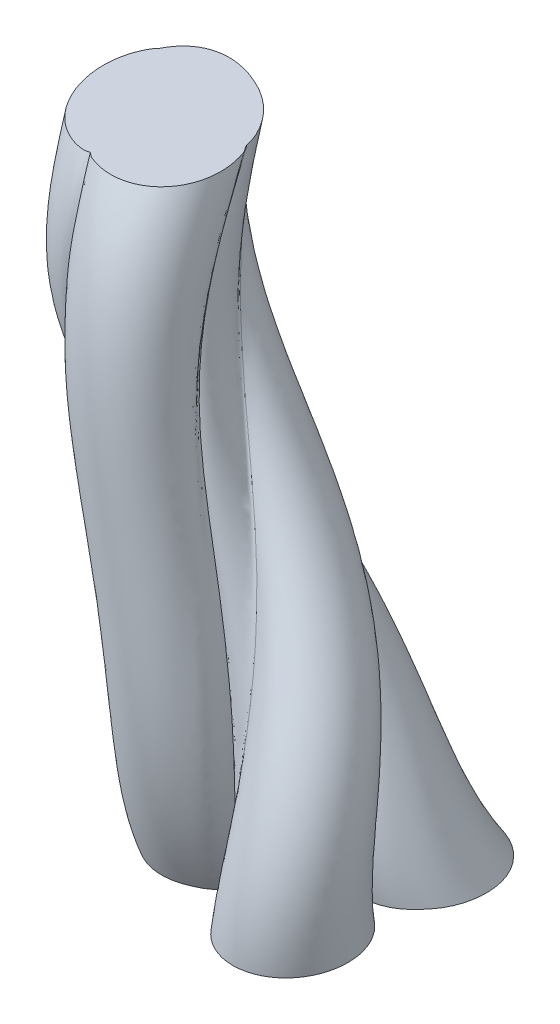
SolidWorks part; units mm, degrees
ref_plane "Front Plane" through (0, 0, 0) normal (0, 0, 1) x (1, 0, 0)
ref_plane "Top Plane" through (0, 0, 0) normal (0, 1, 0) x (1, 0, 0)
ref_plane "Right Plane" through (0, 0, 0) normal (1, 0, 0) x (0, 0, -1)
sketch "Sketch1" plane through (0, 0, 0) normal (0, 1, 0) x (1, 0, 0)
  line L0 (-4.3301, 7.5) -> (0, 0) construction
  line L1 (8.6603, 0) -> (4.3301, 7.5) construction
  line L2 (4.3301, 7.5) -> (-4.3301, 7.5) construction
  line L3 (-4.3301, 7.5) -> (-8.6603, 0) construction
  line L4 (-8.6603, 0) -> (-4.3301, -7.5) construction
  line L5 (-4.3301, -7.5) -> (4.3301, -7.5) construction
  line L6 (4.3301, -7.5) -> (8.6603, 0) construction
  circle A0 centre (0, 0) radius 7.5 construction
  arc A1 (1.5828, 3.6239) -> (-3.9298, 0.4412) centre (-2.1651, 3.75) ccw
  arc A2 (2.347, -3.1827) -> (2.347, 3.1827) centre (4.3301, 0) ccw
  arc A3 (-3.9298, -0.4412) -> (1.5828, -3.6239) centre (-2.1651, -3.75) ccw
  arc A4 (-3.9298, 0.4412) -> (-2.1651, 0) centre (-2.1651, 3.75) ccw
  arc A5 (1.5828, 3.6239) -> (1.0825, 1.875) centre (-2.1651, 3.75) cw
  arc A6 (-3.9298, -0.4412) -> (-2.1651, 0) centre (-2.1651, -3.75) cw
  arc A7 (2.347, 3.1827) -> (1.0825, 1.875) centre (4.3301, 0) ccw
  arc A8 (2.347, -3.1827) -> (1.0825, -1.875) centre (4.3301, 0) cw
  arc A9 (1.5828, -3.6239) -> (1.0825, -1.875) centre (-2.1651, -3.75) ccw
  point P18 (0, 0)
  dimension "D1" = 3
ref_plane "Plane1" through (0, 40, 0) normal (0, 1, 0) x (1, 0, 0)
sketch "Sketch2" plane through (0, 40, 0) normal (0, 1, 0) x (1, 0, 0)
  line L0 (0.4499, 0) -> (-7.0501, 0) construction
  circle A1 centre (-7.0501, 0) radius 4
  ellipse E0 centre (-5.5501, 0) end of major axis (-5.5501, 8) minor radius 6 construction
sketch "Sketch3" plane through (0, 0, 0) normal (0, 0, 1) x (1, 0, 0)
  line L2 (8.6603, 0) -> (4.3301, 0) construction
  line L3 (0.4499, 40) -> (-11.5501, 40) construction
  line L4 (0.4499, 40) -> (-7.0501, 40) construction
  line L5 (-3.0501, 40) -> (-11.0501, 40) construction
  spline S0 degree 3 poles (-3.0501, 40) (-8.4709, 24.9507) (10.2522, 14.9185) (8.6603, 0) knots 0 0 0 0 1 1 1 1
loft "Loft33" add profiles "Sketch2", "Sketch1"
other "Flex1" parameters "D0"=180, "D1"=0, "D2"=0
sketch "Sketch4" plane through (0, 0, 0) normal (0, 0, 1) x (1, 0, 0)
  line L1 (-16.0314, 36.3224) -> (9.5326, 36.3224)
  line L2 (-16.0314, 36.3224) -> (-16.0314, 3.0951)
  line L3 (-16.0314, 3.0951) -> (9.5326, 3.0951)
  line L4 (9.5326, 36.3224) -> (9.5326, 3.0951)
extrude "Cut-Extrude1" cut sketch "Sketch4" against normal through all and the other way through all flip side to cut
